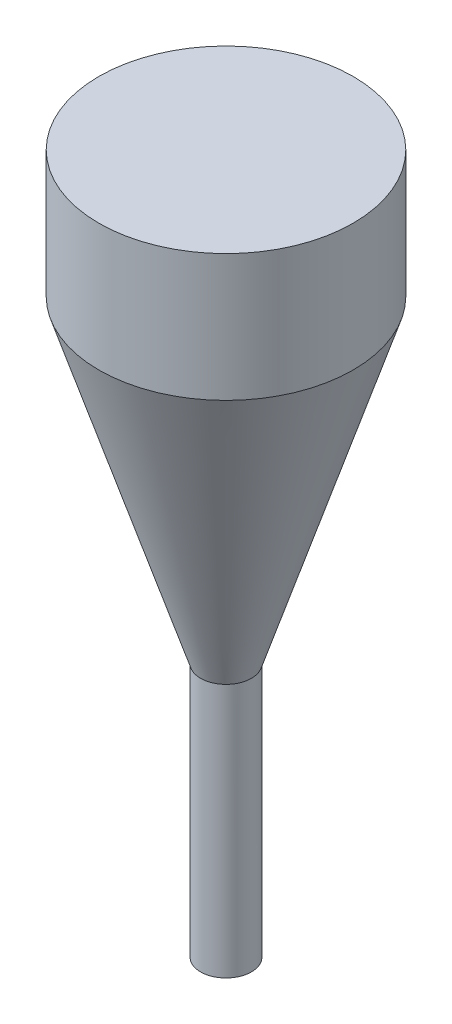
SolidWorks part; units mm, degrees
ref_plane "Front Plane" through (0, 0, 0) normal (0, 0, 1) x (1, 0, 0)
ref_plane "Top Plane" through (0, 0, 0) normal (0, 1, 0) x (1, 0, 0)
ref_plane "Right Plane" through (0, 0, 0) normal (1, 0, 0) x (0, 0, -1)
sketch "Sketch1" plane through (0, 0, 0) normal (0, 0, 1) x (1, 0, 0)
  line L0 (0, 0) -> (0, 35)
  line L1 (0, 35) -> (10, 35)
  line L2 (10, 35) -> (10, 25)
  line L3 (10, 25) -> (2, 0)
  line L5 (2, 0) -> (0, 0)
  point P8 (-0.0933, 0)
  dimension "D1" = 10
  dimension "D2" = 35
  dimension "D3" = 10
  dimension "D4" = 2
revolve "Revolve1" add sketch "Sketch1" angle 360 about L0
sketch "Sketch2" plane through (0, 0, 0) normal (0, -1, 0) x (1, 0, 0)
  circle A1 centre (0, 0) radius 2
  circle A2 centre (0, 0) radius 2
  dimension "D1" = 0
extrude "Boss-Extrude1" add sketch "Sketch2" along normal blind 20
